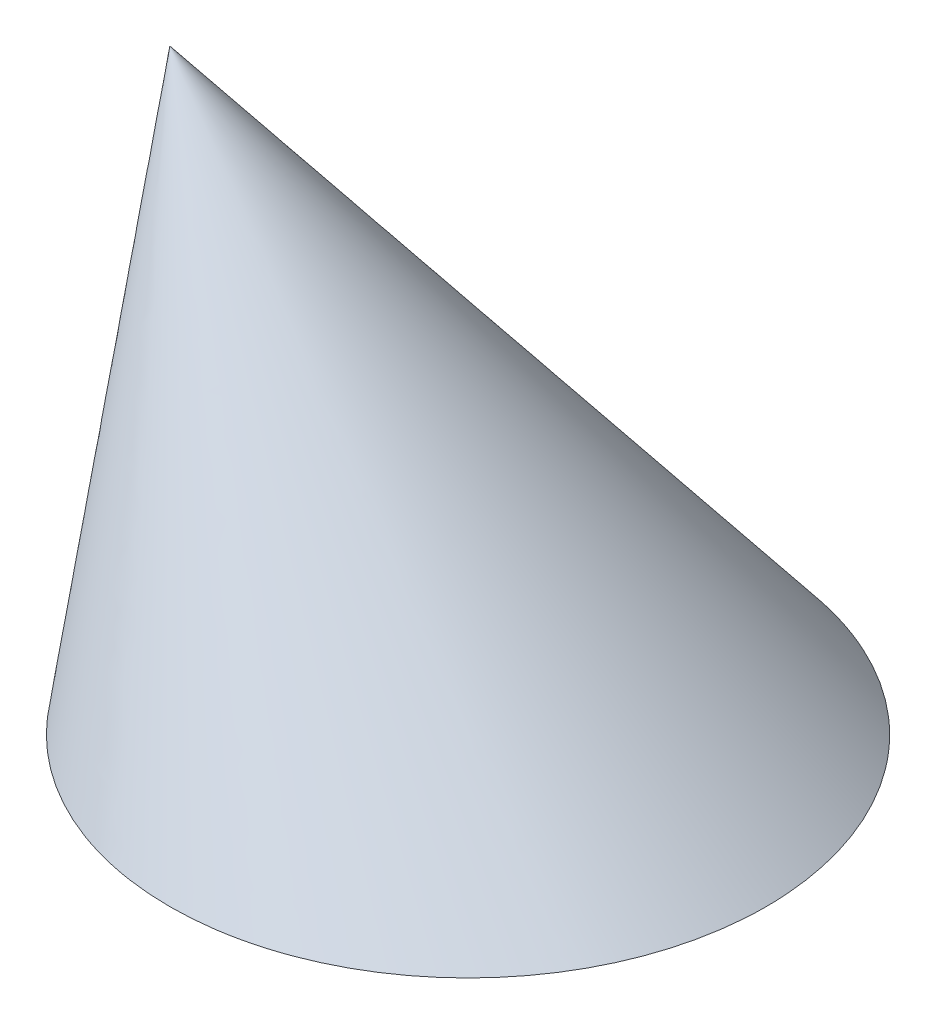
SolidWorks part; units mm, degrees
ref_plane "前视基准面" through (0, 0, 0) normal (0, 0, 1) x (1, 0, 0)
ref_plane "上视基准面" through (0, 0, 0) normal (0, 1, 0) x (1, 0, 0)
ref_plane "右视基准面" through (0, 0, 0) normal (1, 0, 0) x (0, 0, -1)
sketch "草图1" plane through (0, 0, 0) normal (0, 1, 0) x (1, 0, 0)
  line L0 (0, 0) -> (-1000, 0) construction
  circle A0 centre (0, 0) radius 1000
  dimension "D" = 2000
sketch "草图3" plane through (0, 0, 0) normal (0, 0, 1) x (1, 0, 0)
  point P0 (-1000, 1500)
  dimension "H" = 1500
loft "放样1" add profiles "草图1", "草图3"
